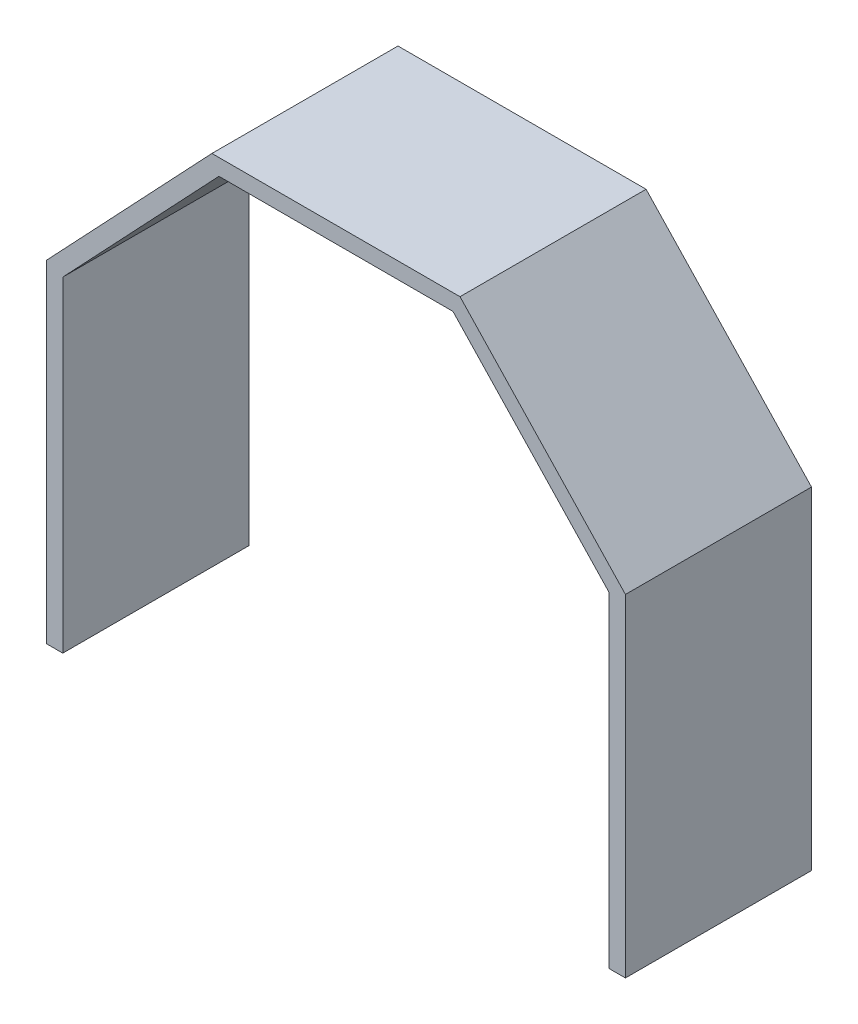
SolidWorks part; units mm, degrees
ref_plane "Front Plane" through (0, 0, 0) normal (0, 0, 1) x (1, 0, 0)
ref_plane "Top Plane" through (0, 0, 0) normal (0, 1, 0) x (1, 0, 0)
ref_plane "Right Plane" through (0, 0, 0) normal (1, 0, 0) x (0, 0, -1)
sketch "Sketch1" plane through (0, 0, 0) normal (0, 0, 1) x (1, 0, 0)
  line L0 (-33.9159, 36.76) -> (35.56, 36.76) construction
  line L2 (-35.56, 15.24) -> (-35.56, -15.24)
  line L4 (35.56, 15.24) -> (35.56, -15.24)
  line L5 (-33.56, -25.5651) -> (-33.56, 14.445)
  line L7 (-35.56, -15.24) -> (-35.56, -25.5651)
  line L8 (-15.24, 36.76) -> (15.24, 36.76)
  line L9 (-35.56, 15.24) -> (-15.24, 36.76)
  line L10 (15.24, 36.76) -> (35.56, 15.24)
  line L11 (-35.56, -25.5651) -> (-33.56, -25.5651)
  line L12 (35.56, -15.24) -> (35.56, -25.5651)
  line L14 (33.56, -25.5651) -> (33.56, 14.445)
  line L15 (33.56, 14.445) -> (14.3778, 34.76)
  line L16 (-33.56, 14.445) -> (-14.3778, 34.76)
  line L17 (-14.3778, 34.76) -> (0, 34.76)
  line L18 (14.3778, 34.76) -> (0, 34.76)
  line L19 (33.56, -25.5651) -> (35.56, -25.5651)
  point P0 (0, 0)
  point P14 (0, 0)
  point P15 (0, 34.76)
  point P18 (-20.8433, 33.9346)
  point P23 (0, 0)
  dimension "D1" = 30.48
  dimension "D2" = 71.12
  dimension "D3" = 10.3251
  dimension "D4" = 2
  dimension "D6" = 2
extrude "Boss-Extrude1" add sketch "Sketch1" along normal blind 22.86
